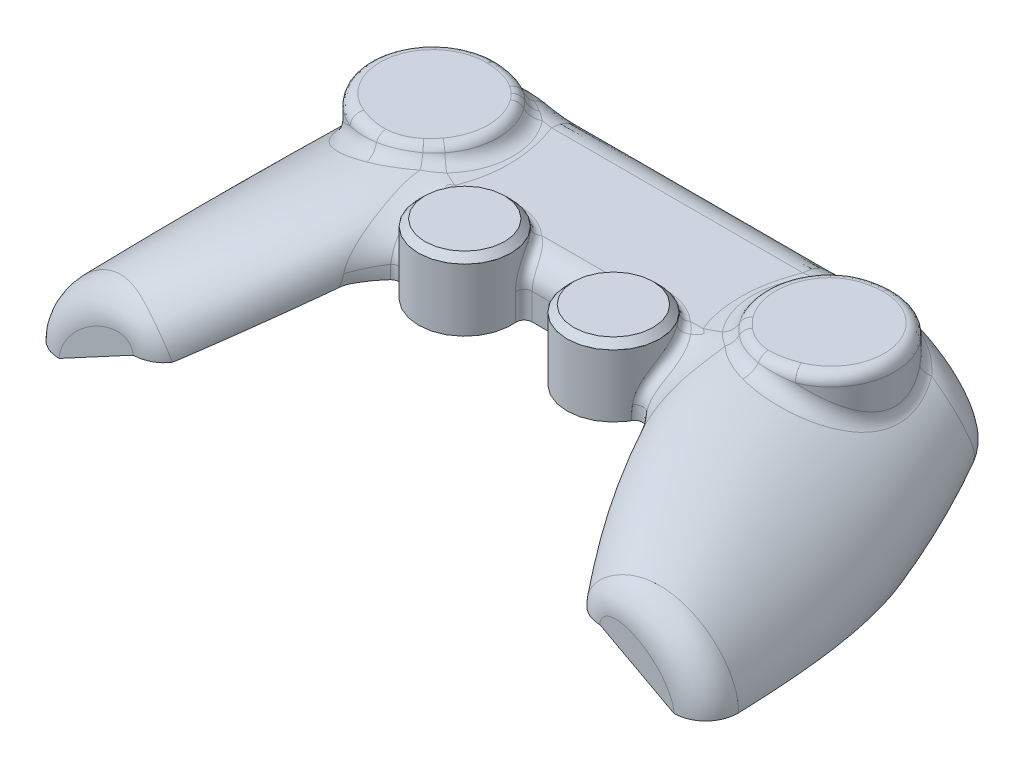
SolidWorks part; units mm, degrees
ref_plane "Front Plane" through (0, 0, 0) normal (0, 0, 1) x (1, 0, 0)
ref_plane "Top Plane" through (0, 0, 0) normal (0, 1, 0) x (1, 0, 0)
ref_plane "Right Plane" through (0, 0, 0) normal (1, 0, 0) x (0, 0, -1)
body saved out of another part "Stock-Controller Body-1"
sketch "Sketch3" plane through (0, 0, 0) normal (0, -1, 0) x (1, 0, 0)
  circle A0 centre (44, 0) radius 7.5 construction
  circle A1 centre (44, 0) radius 7.5
  circle A2 centre (-44, 0) radius 7.5 construction
  circle A3 centre (-44, 0) radius 7.5
  circle A4 centre (44, 0) radius 5.5
  circle A5 centre (-44, 0) radius 5.5
  dimension "D1" = 2
extrude "Standoff Cut" cut sketch "Sketch3" against normal up to surface (18 mm away)
fillet "Fillet1" radius 3 8 edges at (51.4886, 18, 0.4142) (-51.4886, 18, 0.4142) (-51.4915, 21.3536, 0.3565) (51.4847, 21.3387, -0.4781) (44.4471, 18.007, 7.4867)
fillet "Fillet2" radius 2 4 edges at (-49.4914, 18, 0.3083) (-38.5086, 18, -0.3083) (49.4914, 18, 0.3083) (38.5086, 18, -0.3083)
sketch "Sketch5" plane through (0, -30.9949, 0) normal (0, -1, 0) x (1, 0, 0)
  line L0 (-51.1544, 45) -> (-119.2285, 27) construction
  line L1 (-109.8172, 0) -> (109.8172, 0) construction
  line L2 (-65.2791, -29) -> (-101.848, 99) construction
  line L3 (-44, -28) -> (-44, 41.4594) construction
  line L4 (0, -28) -> (0, 28) construction
  line L5 (65.2791, -29) -> (101.848, 99) construction
  line L6 (66.743, 75) -> (125.2773, 62) construction
  line L7 (51.1544, 45) -> (119.2285, 27) construction
  line L8 (44, -28) -> (44, 41.4594) construction
  line L9 (-66.743, 75) -> (-125.2773, 62) construction
  line L10 (-51.1544, 45) -> (-119.2285, 27)
  line L11 (-109.8172, 0) -> (-95, 0)
  line L12 (-65.2791, -29) -> (-68.1187, -19.0607)
  line L13 (-44, -28) -> (-44, 41.4594)
  line L14 (0, -28) -> (0, 28)
  line L15 (65.2791, -29) -> (68.1187, -19.0607)
  line L16 (66.743, 75) -> (125.2773, 62)
  line L17 (51.1544, 45) -> (119.2285, 27)
  line L18 (44, -28) -> (44, 41.4594)
  line L19 (-66.743, 75) -> (-125.2773, 62)
  line L20 (-79.1888, 19.6872) -> (-101.848, 99)
  line L21 (-54.1513, 0) -> (54.1513, 0)
  line L22 (79.1888, 19.6872) -> (101.848, 99)
  line L23 (95, 0) -> (109.8172, 0)
  arc A1 (74.4876, -19.9934) -> (82.3762, 18.5901) centre (75, 0) ccw
  arc A2 (74.4876, -19.9934) -> (82.3762, 18.5901) centre (75, 0) ccw
  arc A3 (-82.3762, 18.5901) -> (-74.4876, -19.9934) centre (-75, 0) ccw
  arc A4 (-82.3762, 18.5901) -> (-74.4876, -19.9934) centre (-75, 0) ccw
  spline S7 degree 3 poles (2800.6356, -1190.2882) (790.0799, -168.2209) (104.6097, 101.7716) (56.3444, 9.4619) (56.1029, 8.9533) (55.6585, 7.9142) (55.4572, 7.3873) (54.9187, 5.7946) (54.6446, 4.7128) (54.3616, 3.0601) (54.2886, 2.5042) (54.1869, 1.3819) (54.1583, 0.8156) (54.1407, -0.8683) (54.218, -1.9812) (54.4656, -3.6363) (54.5701, -4.1856) (54.824, -5.2793) (54.9742, -5.8262) (55.4867, -7.4365) (55.9097, -8.4705) (101.2416, -98.6964) (769.3109, 114.2947) (2868.9277, 1021.4719) knots -11.399373 -11.399373 -11.399373 -11.399373 0.125 0.125 0.1875 0.1875 0.25 0.25 0.375 0.375 0.4375 0.4375 0.5 0.5 0.625 0.625 0.6875 0.6875 0.75 0.75 0.875 0.875 12.06884 12.06884 12.06884 12.06884 only from (58.3927, 12.8192) to (58.1465, -12.3426)
  spline S8 degree 3 poles (2216.0652, 2069.2412) (-2273.5779, -2013.3089) (2414.4628, 1972.8094) (-2079.2492, -2113.318) knots -45.852131 -45.852131 -45.852131 -45.852131 55.159259 55.159259 55.159259 55.159259 only from (58.1465, -12.3426) to (60.141, -14.6112)
  spline S9 degree 3 poles (1793.5552, 2431.3392) (-1868.823, -2391.5551) (2015.9436, 2348.9281) (-1648.2975, -2476.3267) knots -44.554397 -44.554397 -44.554397 -44.554397 53.022818 53.022818 53.022818 53.022818 only from (60.141, -14.6112) to (62.8637, -16.7599)
  spline S10 degree 3 poles (1268.8113, 2728.5176) (52.6786, 155.9429) (24.6834, -1.1394) (66.0384, -18.3865) (66.5205, -18.5647) (67.4909, -18.8851) (67.9792, -19.0274) (69.4527, -19.4084) (70.4459, -19.6018) (142.922, -29.7023) (263.6858, 233.8552) (814.4498, 2883.5236) knots -10.596333 -10.596333 -10.596333 -10.596333 0.25 0.25 0.375 0.375 0.5 0.5 0.75 0.75 18.566868 18.566868 18.566868 18.566868 only from (62.8637, -16.7599) to (74.4876, -19.9934)
  spline S11 degree 3 poles (1249.5003, 2776.8926) (139.5762, -243.5878) (147.5322, -1.7188) (79.0283, 19.746) (78.1714, 19.976) (24.537, 31.503) (-50.3193, -120.6668) (-483.3913, -2925.2889) knots -19.761902 -19.761902 -19.761902 -19.761902 0.25 0.25 0.5 0.5 15.831725 15.831725 15.831725 15.831725 only from (82.3762, 18.5901) to (72.0656, 20.6626)
  spline S12 degree 3 poles (919.7347, -2854.7568) (247.2638, -243.4608) (124.3996, 32.3894) (68.3901, 20.1112) (67.5038, 19.8351) (66.202, 19.3031) (65.7722, 19.1055) (64.9386, 18.6786) (64.5325, 18.4483) (-14.3362, -30.7115) (319.8956, -719.4502) (1448.1655, -2639.2031) knots -14.978386 -14.978386 -14.978386 -14.978386 0.25 0.25 0.5 0.5 0.625 0.625 0.75 0.75 25.550399 25.550399 25.550399 25.550399 only from (72.0656, 20.6626) to (61.8901, 16.5269)
  spline S13 degree 3 poles (-2008.6281, 2183.8701) (254.0656, -23.0298) (96.5806, 52.9101) (30.5961, -15.979) (81.7531, -122.7538) (2151.8333, -2133.8829) knots -30.588433 -30.588433 -30.588433 -30.588433 0.5 0.5 25.556609 25.556609 25.556609 25.556609 only from (61.8901, 16.5269) to (58.3927, 12.8192)
  spline S14 degree 3 poles (58.3927, 12.8192) (57.7211, 11.909) (57.1255, 10.9557) (56.3444, 9.4619) (56.1029, 8.9533) (55.6585, 7.9142) (55.4572, 7.3873) (54.9187, 5.7946) (54.6446, 4.7128) (54.3616, 3.0601) (54.2886, 2.5042) (54.1869, 1.3819) (54.1583, 0.8156) (54.1407, -0.8683) (54.218, -1.9812) (54.4656, -3.6363) (54.5701, -4.1856) (54.824, -5.2793) (54.9742, -5.8262) (55.4867, -7.4365) (55.9097, -8.4705) (56.911, -10.4634) (57.4893, -11.4221) (58.1465, -12.3426) knots 0 0 0 0 0.125 0.125 0.1875 0.1875 0.25 0.25 0.375 0.375 0.4375 0.4375 0.5 0.5 0.625 0.625 0.6875 0.6875 0.75 0.75 0.875 0.875 1 1 1 1
  spline S15 degree 3 poles (58.1465, -12.3426) (58.7346, -13.1663) (59.4053, -13.9173) (60.141, -14.6112) knots 0 0 0 0 1 1 1 1
  spline S16 degree 3 poles (60.141, -14.6112) (60.9853, -15.4077) (61.8983, -16.117) (62.8637, -16.7599) knots 0 0 0 0 1 1 1 1
  spline S17 degree 3 poles (62.8637, -16.7599) (63.7192, -17.3296) (64.6249, -17.797) (66.0384, -18.3865) (66.5205, -18.5647) (67.4909, -18.8851) (67.9792, -19.0274) (69.4527, -19.4084) (70.4459, -19.6018) (72.4517, -19.8813) (73.4643, -19.9672) (74.4876, -19.9934) knots 0 0 0 0 0.25 0.25 0.375 0.375 0.5 0.5 0.75 0.75 1 1 1 1
  spline S18 degree 3 poles (82.3762, 18.5901) (81.5522, 18.917) (80.7188, 19.2163) (79.0283, 19.746) (78.1714, 19.976) (75.5898, 20.5309) (73.8453, 20.7269) (72.0656, 20.6626) knots 0 0 0 0 0.25 0.25 0.5 0.5 1 1 1 1
  spline S19 degree 3 poles (72.0656, 20.6626) (71.1223, 20.6286) (70.1994, 20.5078) (68.3901, 20.1112) (67.5038, 19.8351) (66.202, 19.3031) (65.7722, 19.1055) (64.9386, 18.6786) (64.5325, 18.4483) (63.3459, 17.7087) (62.5968, 17.1507) (61.8901, 16.5269) knots 0 0 0 0 0.25 0.25 0.5 0.5 0.625 0.625 0.75 0.75 1 1 1 1
  spline S20 degree 3 poles (61.8901, 16.5269) (61.2504, 15.9625) (60.6315, 15.3785) (59.4563, 14.1515) (58.9007, 13.5078) (58.3927, 12.8192) knots 0 0 0 0 0.5 0.5 1 1 1 1
  spline S21 degree 3 poles (-2151.8768, -2133.9252) (-81.7539, -122.7553) (-30.5959, -15.9793) (-96.5803, 52.9098) (-254.0633, -23.0287) (2008.5777, 2183.821) knots -24.556785 -24.556785 -24.556785 -24.556785 0.5 0.5 31.588202 31.588202 31.588202 31.588202 only from (-58.3927, 12.8192) to (-61.8901, 16.5269)
  spline S22 degree 3 poles (-1448.173, -2639.216) (-319.8971, -719.4533) (14.3364, -30.7116) (-64.5325, 18.4483) (-64.9386, 18.6786) (-65.7722, 19.1055) (-66.202, 19.3031) (-67.5038, 19.8351) (-68.3901, 20.1112) (-124.399, 32.3892) (-247.2609, -243.4543) (-919.711, -2854.6647) knots -24.550455 -24.550455 -24.550455 -24.550455 0.25 0.25 0.375 0.375 0.5 0.5 0.75 0.75 15.978207 15.978207 15.978207 15.978207 only from (-61.8901, 16.5269) to (-72.0656, 20.6626)
  spline S23 degree 3 poles (483.3914, -2925.29) (50.3194, -120.6668) (-24.537, 31.503) (-78.1714, 19.976) (-79.0283, 19.746) (-147.5323, -1.7189) (-139.5762, -243.5886) (-1249.5062, 2776.9086) knots -14.831727 -14.831727 -14.831727 -14.831727 0.5 0.5 0.75 0.75 20.761937 20.761937 20.761937 20.761937 only from (-72.0656, 20.6626) to (-82.3762, 18.5901)
  spline S24 degree 3 poles (-814.4465, 2883.5078) (-263.6853, 233.8542) (-142.9219, -29.7023) (-70.4459, -19.6018) (-69.4527, -19.4084) (-67.9792, -19.0274) (-67.4909, -18.8851) (-66.5205, -18.5647) (-66.0384, -18.3865) (-24.6837, -1.1395) (-52.6782, 155.9406) (-1268.7847, 2728.4613) knots -17.566832 -17.566832 -17.566832 -17.566832 0.25 0.25 0.5 0.5 0.625 0.625 0.75 0.75 11.596254 11.596254 11.596254 11.596254 only from (-74.4876, -19.9934) to (-62.8637, -16.7599)
  spline S25 degree 3 poles (1648.366, -2476.4169) (-2015.9936, 2348.9893) (1868.8492, -2391.5893) (-1793.56, 2431.3455) knots -52.023426 -52.023426 -52.023426 -52.023426 45.55444 45.55444 45.55444 45.55444 only from (-62.8637, -16.7599) to (-60.141, -14.6112)
  spline S26 degree 3 poles (2079.1991, -2113.2724) (-2414.4277, 1972.7795) (2273.5606, -2013.2932) (-2216.0644, 2069.2405) knots -54.158884 -54.158884 -54.158884 -54.158884 46.852125 46.852125 46.852125 46.852125 only from (-60.141, -14.6112) to (-58.1465, -12.3426)
  spline S27 degree 3 poles (-2868.9121, 1021.4652) (-769.3076, 114.2937) (-101.2415, -98.6962) (-55.9097, -8.4705) (-55.4867, -7.4365) (-54.9742, -5.8262) (-54.824, -5.2793) (-54.5701, -4.1856) (-54.4656, -3.6363) (-54.218, -1.9812) (-54.1407, -0.8683) (-54.1583, 0.8156) (-54.1869, 1.3819) (-54.2886, 2.5042) (-54.3616, 3.0601) (-54.6446, 4.7128) (-54.9187, 5.7946) (-55.4572, 7.3873) (-55.6585, 7.9142) (-56.1029, 8.9533) (-56.3444, 9.4619) (-104.6098, 101.7717) (-790.0825, -168.2219) (-2800.6469, -1190.2939) knots -11.068812 -11.068812 -11.068812 -11.068812 0.125 0.125 0.25 0.25 0.3125 0.3125 0.375 0.375 0.5 0.5 0.5625 0.5625 0.625 0.625 0.75 0.75 0.8125 0.8125 0.875 0.875 12.399395 12.399395 12.399395 12.399395 only from (-58.1465, -12.3426) to (-58.3927, 12.8192)
  spline S28 degree 3 poles (-58.3927, 12.8192) (-58.9007, 13.5078) (-59.4563, 14.1515) (-60.6315, 15.3785) (-61.2504, 15.9625) (-61.8901, 16.5269) knots 0 0 0 0 0.5 0.5 1 1 1 1
  spline S29 degree 3 poles (-61.8901, 16.5269) (-62.5968, 17.1507) (-63.3459, 17.7087) (-64.5325, 18.4483) (-64.9386, 18.6786) (-65.7722, 19.1055) (-66.202, 19.3031) (-67.5038, 19.8351) (-68.3901, 20.1112) (-70.1994, 20.5078) (-71.1223, 20.6286) (-72.0656, 20.6626) knots 0 0 0 0 0.25 0.25 0.375 0.375 0.5 0.5 0.75 0.75 1 1 1 1
  spline S30 degree 3 poles (-72.0656, 20.6626) (-73.8453, 20.7269) (-75.5898, 20.5309) (-78.1714, 19.976) (-79.0283, 19.746) (-80.7188, 19.2163) (-81.5522, 18.917) (-82.3762, 18.5901) knots 0 0 0 0 0.5 0.5 0.75 0.75 1 1 1 1
  spline S31 degree 3 poles (-74.4876, -19.9934) (-73.4643, -19.9672) (-72.4517, -19.8813) (-70.4459, -19.6018) (-69.4527, -19.4084) (-67.9792, -19.0274) (-67.4909, -18.8851) (-66.5205, -18.5647) (-66.0384, -18.3865) (-64.6249, -17.797) (-63.7192, -17.3296) (-62.8637, -16.7599) knots 0 0 0 0 0.25 0.25 0.5 0.5 0.625 0.625 0.75 0.75 1 1 1 1
  spline S32 degree 3 poles (-62.8637, -16.7599) (-61.8983, -16.117) (-60.9853, -15.4077) (-60.141, -14.6112) knots 0 0 0 0 1 1 1 1
  spline S33 degree 3 poles (-60.141, -14.6112) (-59.4053, -13.9173) (-58.7346, -13.1663) (-58.1465, -12.3426) knots 0 0 0 0 1 1 1 1
  spline S34 degree 3 poles (-58.1465, -12.3426) (-57.4893, -11.4221) (-56.911, -10.4634) (-55.9097, -8.4705) (-55.4867, -7.4365) (-54.9742, -5.8262) (-54.824, -5.2793) (-54.5701, -4.1856) (-54.4656, -3.6363) (-54.218, -1.9812) (-54.1407, -0.8683) (-54.1583, 0.8156) (-54.1869, 1.3819) (-54.2886, 2.5042) (-54.3616, 3.0601) (-54.6446, 4.7128) (-54.9187, 5.7946) (-55.4572, 7.3873) (-55.6585, 7.9142) (-56.1029, 8.9533) (-56.3444, 9.4619) (-57.1255, 10.9557) (-57.7211, 11.909) (-58.3927, 12.8192) knots 0 0 0 0 0.125 0.125 0.25 0.25 0.3125 0.3125 0.375 0.375 0.5 0.5 0.5625 0.5625 0.625 0.625 0.75 0.75 0.8125 0.8125 0.875 0.875 1 1 1 1
  dimension "D1" = 0
  dimension "D2" = 0
extrude "Ribs" add sketch "Sketch5" against normal up to body separate body thin
sketch "Sketch6" plane through (0, 0, 0) normal (0, 0, 1) x (1, 0, 0)
  line L0 (-116.2976, -30.9949) -> (-127.7943, -30.9949) construction
  line L1 (-88.3463, -16.2228) -> (-115.3498, -30.7561) construction
  line L2 (-78.7434, -15.984) -> (-87.3985, -15.984) construction
  line L3 (-55.5133, -0.3549) -> (-77.606, -15.6291) construction
  line L4 (-54.3759, 0) -> (-43.2892, 0) construction
  line L5 (-43.2892, 0) -> (-10.5835, 0) construction
  line L6 (-7.5978, 0) -> (-10.5835, 0) construction
  line L7 (-7.5978, 0) -> (7.5978, 0) construction
  line L8 (7.5978, 0) -> (10.5835, 0) construction
  line L9 (10.5835, 0) -> (43.2892, 0) construction
  line L10 (48.1198, 0) -> (43.2892, 0) construction
  line L11 (54.3759, 0) -> (48.1198, 0) construction
  line L12 (77.606, -15.6291) -> (55.5133, -0.3549) construction
  line L13 (87.3985, -15.984) -> (78.7434, -15.984) construction
  line L14 (115.3498, -30.7561) -> (88.3463, -16.2228) construction
  line L15 (127.7943, -30.9949) -> (116.2976, -30.9949) construction
  line L16 (-116.2976, -30.9949) -> (-127.7943, -30.9949)
  line L17 (-88.3463, -16.2228) -> (-115.3498, -30.7561)
  line L18 (-78.7434, -15.984) -> (-87.3985, -15.984)
  line L19 (-55.5133, -0.3549) -> (-77.606, -15.6291)
  line L20 (-54.3759, 0) -> (-43.2892, 0)
  line L21 (-43.2892, 0) -> (-10.5835, 0)
  line L22 (-7.5978, 0) -> (-10.5835, 0)
  line L23 (-7.5978, 0) -> (7.5978, 0)
  line L24 (7.5978, 0) -> (10.5835, 0)
  line L25 (10.5835, 0) -> (43.2892, 0)
  line L26 (48.1198, 0) -> (43.2892, 0)
  line L27 (54.3759, 0) -> (48.1198, 0)
  line L28 (77.606, -15.6291) -> (55.5133, -0.3549)
  line L29 (87.3985, -15.984) -> (78.7434, -15.984)
  line L30 (115.3498, -30.7561) -> (88.3463, -16.2228)
  line L31 (127.7943, -30.9949) -> (116.2976, -30.9949)
  arc A0 (-116.2976, -30.9949) -> (-115.3498, -30.7561) centre (-116.2976, -28.9949) ccw construction
  arc A1 (-87.3985, -15.984) -> (-88.3463, -16.2228) centre (-87.3985, -17.984) ccw construction
  arc A2 (-78.7434, -15.984) -> (-77.606, -15.6291) centre (-78.7434, -13.984) ccw construction
  arc A3 (-54.3759, 0) -> (-55.5133, -0.3549) centre (-54.3759, -2) ccw construction
  arc A4 (55.5133, -0.3549) -> (54.3759, 0) centre (54.3759, -2) ccw construction
  arc A5 (77.606, -15.6291) -> (78.7434, -15.984) centre (78.7434, -13.984) ccw construction
  arc A6 (88.3463, -16.2228) -> (87.3985, -15.984) centre (87.3985, -17.984) ccw construction
  arc A7 (115.3498, -30.7561) -> (116.2976, -30.9949) centre (116.2976, -28.9949) ccw construction
  arc A8 (-116.2976, -30.9949) -> (-115.3498, -30.7561) centre (-116.2976, -28.9949) ccw
  arc A9 (-87.3985, -15.984) -> (-88.3463, -16.2228) centre (-87.3985, -17.984) ccw
  arc A10 (-78.7434, -15.984) -> (-77.606, -15.6291) centre (-78.7434, -13.984) ccw
  arc A11 (-54.3759, 0) -> (-55.5133, -0.3549) centre (-54.3759, -2) ccw
  arc A12 (55.5133, -0.3549) -> (54.3759, 0) centre (54.3759, -2) ccw
  arc A13 (77.606, -15.6291) -> (78.7434, -15.984) centre (78.7434, -13.984) ccw
  arc A14 (88.3463, -16.2228) -> (87.3985, -15.984) centre (87.3985, -17.984) ccw
  arc A15 (115.3498, -30.7561) -> (116.2976, -30.9949) centre (116.2976, -28.9949) ccw
extrude "Rib Cuts" cut sketch "Sketch6" against normal through all both and the other way through all
hole_wizard "M5x0.8 Tapped Hole1" positions "Sketch1" profile "Sketch2" tap size "M5x0.8" standard "ANSI Metric"
sketch "Sketch1" plane through (0, 0, 0) normal (0, -1, 0) x (-1, 0, 0)
  point P0 (-44, 0)
  point P3 (44, 0)
sketch "Sketch2" plane through (44, 0, 0) normal (1, 0, 0) x (0, 0, -1)
  line L0 (0, 0) -> (0, 16.2618)
  line L1 (0, 16.2618) -> (2.1, 15)
  line L2 (2.1, 15) -> (2.1, 0.425)
  line L3 (2.1, 0.425) -> (2.525, 0)
  line L5 (2.525, 0) -> (0, 0)
  line L6 (-2.1, 0.425) -> (-2.525, 0) construction
  line L10 (0, 16.2618) -> (-2.1, 15) construction
  line L11 (0, -6.35) -> (0, 107.95) construction
  dimension "Tap Drill Dia." = 4.2
  dimension "Tap Drill Depth" = 15
  dimension "Near C'Sink Dia." = 5.05
  dimension "Near C'Sink Angle" = 90
  dimension "Drill Angle" = 118
sketch "Sketch7" plane through (0, 0, 0) normal (0, -1, 0) x (1, 0, 0)
  line L0 (96, 26) -> (-96, 26)
  line L1 (-96, 26) -> (-96, -26)
  line L2 (-96, -26) -> (96, -26)
  line L3 (96, -26) -> (96, 26)
  line L4 (95, 25) -> (-95, 25)
  line L5 (95, -25) -> (95, 25)
  line L6 (-95, -25) -> (95, -25)
  line L7 (-95, 25) -> (-95, -25)
  line L8 (95, 25) -> (-95, 25) construction
  line L9 (95, -25) -> (95, 25) construction
  line L10 (-95, -25) -> (95, -25) construction
  line L11 (-95, 25) -> (-95, -25) construction
  dimension "D1" = 0
  dimension "D2" = 1
extrude "PCB Cut" cut sketch "Sketch7" against normal blind 1.6 and the other way through all
sketch "Sketch8" plane through (0, 26, 0) normal (0, 1, 0) x (1, 0, 0)
  circle A0 centre (-88, 0) radius 4.7
  circle A1 centre (-88, 0) radius 4.5
  circle A2 centre (-88, 0) radius 4.5 construction
  circle A3 centre (-75, -13) radius 4.5
  circle A4 centre (-75, -13) radius 4.5 construction
  circle A5 centre (-62, 0) radius 4.5
  circle A6 centre (-62, 0) radius 4.5 construction
  circle A7 centre (-75, 13) radius 4.5
  circle A8 centre (-75, 13) radius 4.5 construction
  circle A9 centre (-75, -13) radius 4.7
  circle A10 centre (-62, 0) radius 4.7
  circle A11 centre (-75, 13) radius 4.7
  dimension "D1" = 0
  dimension "D2" = 0
  dimension "D3" = 0
  dimension "D4" = 0
  dimension "D5" = 0.2
extrude "Button Cut" cut sketch "Sketch8" against normal through all
sketch "Sketch9" plane through (0, 26, 0) normal (0, 1, 0) x (1, 0, 0)
  line L0 (69, 1) -> (69, -1) construction
  line L1 (67, -3) -> (62, -3) construction
  line L2 (58, -0.5) -> (58, 0.5) construction
  line L3 (62, 3) -> (67, 3) construction
  line L4 (76, 6) -> (74, 6) construction
  line L5 (72, 8) -> (72, 13) construction
  line L6 (74.5, 17) -> (75.5, 17) construction
  line L7 (78, 13) -> (78, 8) construction
  line L8 (75.5, -17) -> (74.5, -17) construction
  line L9 (72, -13) -> (72, -8) construction
  line L10 (74, -6) -> (76, -6) construction
  line L11 (78, -8) -> (78, -13) construction
  line L12 (88, -3) -> (83, -3) construction
  line L13 (81, -1) -> (81, 1) construction
  line L14 (83, 3) -> (88, 3) construction
  line L15 (92, 0.5) -> (92, -0.5) construction
  line L16 (69, 1) -> (69, -1) construction
  line L17 (67, -3) -> (62, -3) construction
  line L18 (58, -0.5) -> (58, 0.5) construction
  line L19 (62, 3) -> (67, 3) construction
  line L20 (76, 6) -> (74, 6) construction
  line L21 (72, 8) -> (72, 13) construction
  line L22 (74.5, 17) -> (75.5, 17) construction
  line L23 (78, 13) -> (78, 8) construction
  line L24 (75.5, -17) -> (74.5, -17) construction
  line L25 (72, -13) -> (72, -8) construction
  line L26 (74, -6) -> (76, -6) construction
  line L27 (78, -8) -> (78, -13) construction
  line L28 (88, -3) -> (83, -3) construction
  line L29 (81, -1) -> (81, 1) construction
  line L30 (83, 3) -> (88, 3) construction
  line L31 (92, 0.5) -> (92, -0.5) construction
  line L32 (69.2, 1) -> (69.2, -1)
  line L33 (67, -3.2) -> (62, -3.2)
  line L34 (57.8, -0.5) -> (57.8, 0.5)
  line L35 (62, 3.2) -> (67, 3.2)
  line L36 (76, 5.8) -> (74, 5.8)
  line L37 (71.8, 8) -> (71.8, 13)
  line L38 (74.5, 17.2) -> (75.5, 17.2)
  line L39 (78.2, 13) -> (78.2, 8)
  line L40 (75.5, -17.2) -> (74.5, -17.2)
  line L41 (71.8, -13) -> (71.8, -8)
  line L42 (74, -5.8) -> (76, -5.8)
  line L43 (78.2, -8) -> (78.2, -13)
  line L44 (88, -3.2) -> (83, -3.2)
  line L45 (80.8, -1) -> (80.8, 1)
  line L46 (83, 3.2) -> (88, 3.2)
  line L47 (92.2, 0.5) -> (92.2, -0.5)
  arc A0 (69, 1) -> (67, 3) centre (67, 1) ccw construction
  arc A1 (67, -3) -> (69, -1) centre (67, -1) ccw construction
  arc A2 (76, 6) -> (78, 8) centre (76, 8) ccw construction
  arc A3 (72, 8) -> (74, 6) centre (74, 8) ccw construction
  arc A4 (74, -6) -> (72, -8) centre (74, -8) ccw construction
  arc A5 (78, -8) -> (76, -6) centre (76, -8) ccw construction
  arc A6 (81, -1) -> (83, -3) centre (83, -1) ccw construction
  arc A7 (83, 3) -> (81, 1) centre (83, 1) ccw construction
  arc A8 (69, 1) -> (67, 3) centre (67, 1) ccw construction
  arc A9 (67, -3) -> (69, -1) centre (67, -1) ccw construction
  arc A10 (76, 6) -> (78, 8) centre (76, 8) ccw construction
  arc A11 (72, 8) -> (74, 6) centre (74, 8) ccw construction
  arc A12 (74, -6) -> (72, -8) centre (74, -8) ccw construction
  arc A13 (78, -8) -> (76, -6) centre (76, -8) ccw construction
  arc A14 (81, -1) -> (83, -3) centre (83, -1) ccw construction
  arc A15 (83, 3) -> (81, 1) centre (83, 1) ccw construction
  arc A16 (67, -3.2) -> (69.2, -1) centre (67, -1) ccw
  arc A17 (69.2, 1) -> (67, 3.2) centre (67, 1) ccw
  arc A18 (71.8, 8) -> (74, 5.8) centre (74, 8) ccw
  arc A19 (76, 5.8) -> (78.2, 8) centre (76, 8) ccw
  arc A20 (74, -5.8) -> (71.8, -8) centre (74, -8) ccw
  arc A21 (78.2, -8) -> (76, -5.8) centre (76, -8) ccw
  arc A22 (80.8, -1) -> (83, -3.2) centre (83, -1) ccw
  arc A23 (83, 3.2) -> (80.8, 1) centre (83, 1) ccw
  spline S0 degree 2 poles (62, -3) (58, -3) (58, -0.5) knots 0 0 0 1 1 1 weights 1 0.707107 1 construction
  spline S1 degree 2 poles (58, 0.5) (58, 3) (62, 3) knots 0 0 0 1 1 1 weights 1 0.707107 1 construction
  spline S2 degree 2 poles (72, 13) (72, 17) (74.5, 17) knots 0 0 0 1 1 1 weights 1 0.707107 1 construction
  spline S3 degree 2 poles (75.5, 17) (78, 17) (78, 13) knots 0 0 0 1 1 1 weights 1 0.707107 1 construction
  spline S4 degree 2 poles (78, -13) (78, -17) (75.5, -17) knots 0 0 0 1 1 1 weights 1 0.707107 1 construction
  spline S5 degree 2 poles (74.5, -17) (72, -17) (72, -13) knots 0 0 0 1 1 1 weights 1 0.707107 1 construction
  spline S6 degree 2 poles (88, 3) (92, 3) (92, 0.5) knots 0 0 0 1 1 1 weights 1 0.707107 1 construction
  spline S7 degree 2 poles (92, -0.5) (92, -3) (88, -3) knots 0 0 0 1 1 1 weights 1 0.707107 1 construction
  spline S8 degree 2 poles (62, -3) (58, -3) (58, -0.5) knots 0 0 0 1 1 1 weights 1 0.707107 1 construction
  spline S9 degree 2 poles (58, 0.5) (58, 3) (62, 3) knots 0 0 0 1 1 1 weights 1 0.707107 1 construction
  spline S10 degree 2 poles (72, 13) (72, 17) (74.5, 17) knots 0 0 0 1 1 1 weights 1 0.707107 1 construction
  spline S11 degree 2 poles (75.5, 17) (78, 17) (78, 13) knots 0 0 0 1 1 1 weights 1 0.707107 1 construction
  spline S12 degree 2 poles (78, -13) (78, -17) (75.5, -17) knots 0 0 0 1 1 1 weights 1 0.707107 1 construction
  spline S13 degree 2 poles (74.5, -17) (72, -17) (72, -13) knots 0 0 0 1 1 1 weights 1 0.707107 1 construction
  spline S14 degree 2 poles (88, 3) (92, 3) (92, 0.5) knots 0 0 0 1 1 1 weights 1 0.707107 1 construction
  spline S15 degree 2 poles (92, -0.5) (92, -3) (88, -3) knots 0 0 0 1 1 1 weights 1 0.707107 1 construction
  spline S16 degree 1 poles (62, -3.2) (57.8, -0.5) knots 0 0 1 1 construction
  spline S17 degree 1 poles (57.8, 0.5) (62, 3.2) knots 0 0 1 1 construction
  spline S18 degree 2 poles (62, -3.2) (61.4466, -3.2029) (60.2814, -2.9976) (59.0056, -2.4804) (58.1498, -1.662) (57.7959, -0.8802) (57.8, -0.5) knots 0 0 0 0.1875 0.375 0.625 0.8125 1 1 1
  spline S19 degree 2 poles (57.8, 0.5) (57.7959, 0.8802) (58.1498, 1.662) (59.0056, 2.4804) (60.2814, 2.9976) (61.4466, 3.2029) (62, 3.2) knots 0 0 0 0.1875 0.375 0.625 0.8125 1 1 1
  spline S20 degree 1 poles (71.8, 13) (74.5, 17.2) knots 0 0 1 1 construction
  spline S21 degree 1 poles (75.5, 17.2) (78.2, 13) knots 0 0 1 1 construction
  spline S22 degree 2 poles (71.8, 13) (71.7971, 13.5534) (72.0024, 14.7186) (72.5196, 15.9944) (73.338, 16.8502) (74.1198, 17.2041) (74.5, 17.2) knots 0 0 0 0.1875 0.375 0.625 0.8125 1 1 1
  spline S23 degree 2 poles (75.5, 17.2) (75.8802, 17.2041) (76.662, 16.8502) (77.4804, 15.9944) (77.9976, 14.7186) (78.2029, 13.5534) (78.2, 13) knots 0 0 0 0.1875 0.375 0.625 0.8125 1 1 1
  spline S24 degree 1 poles (74.5, -17.2) (71.8, -13) knots 0 0 1 1 construction
  spline S25 degree 1 poles (78.2, -13) (75.5, -17.2) knots 0 0 1 1 construction
  spline S26 degree 2 poles (74.5, -17.2) (74.1198, -17.2041) (73.338, -16.8502) (72.5196, -15.9944) (72.0024, -14.7186) (71.7971, -13.5534) (71.8, -13) knots 0 0 0 0.1875 0.375 0.625 0.8125 1 1 1
  spline S27 degree 2 poles (78.2, -13) (78.2029, -13.5534) (77.9976, -14.7186) (77.4804, -15.9944) (76.662, -16.8502) (75.8802, -17.2041) (75.5, -17.2) knots 0 0 0 0.1875 0.375 0.625 0.8125 1 1 1
  spline S28 degree 1 poles (88, 3.2) (92.2, 0.5) knots 0 0 1 1 construction
  spline S29 degree 1 poles (92.2, -0.5) (88, -3.2) knots 0 0 1 1 construction
  spline S30 degree 2 poles (88, 3.2) (88.5534, 3.2029) (89.7186, 2.9976) (90.9944, 2.4804) (91.8502, 1.662) (92.2041, 0.8802) (92.2, 0.5) knots 0 0 0 0.1875 0.375 0.625 0.8125 1 1 1
  spline S31 degree 2 poles (92.2, -0.5) (92.2041, -0.8802) (91.8502, -1.662) (90.9944, -2.4804) (89.7186, -2.9976) (88.5534, -3.2029) (88, -3.2) knots 0 0 0 0.1875 0.375 0.625 0.8125 1 1 1
  dimension "D1" = 0.2
extrude "D-Pad Cuts" cut sketch "Sketch9" against normal through all
sketch "Sketch10" plane through (0, 20, 0) normal (0, 1, 0) x (1, 0, 0)
  circle A0 centre (25, 10) radius 4.5 construction
  circle A1 centre (25, 10) radius 4.5 construction
  circle A2 centre (-25, 10) radius 4.5 construction
  circle A3 centre (-25, 10) radius 4.5 construction
  circle A4 centre (25, 10) radius 4.7
  circle A5 centre (-25, 10) radius 4.7
  dimension "D1" = 0.2
extrude "Center Buttons Cut" cut sketch "Sketch10" against normal through all
sketch "Sketch11" plane through (0, 26, 0) normal (0, 1, 0) x (1, 0, 0)
  line L0 (0, 0) -> (0, 30) construction
  line L1 (-47.3264, 30) -> (47.3264, 30) construction
  circle A0 centre (-28, -35) radius 11
  circle A1 centre (28, -35) radius 11
  dimension "D1" = 22
extrude "Joystick Cut" cut sketch "Sketch11" against normal through all
sketch "Sketch13" plane through (0, 24, 0) normal (0, -1, 0) x (1, 0, 0)
  circle A0 centre (28, 35) radius 11 construction
  circle A1 centre (-28, 35) radius 11 construction
  circle A2 centre (28, 35) radius 11
  circle A3 centre (-28, 35) radius 11
  circle A4 centre (-28, 35) radius 13
  circle A5 centre (28, 35) radius 13
  dimension "D1" = 2
extrude "Joystick Shroud" add sketch "Sketch13" along normal blind 4
